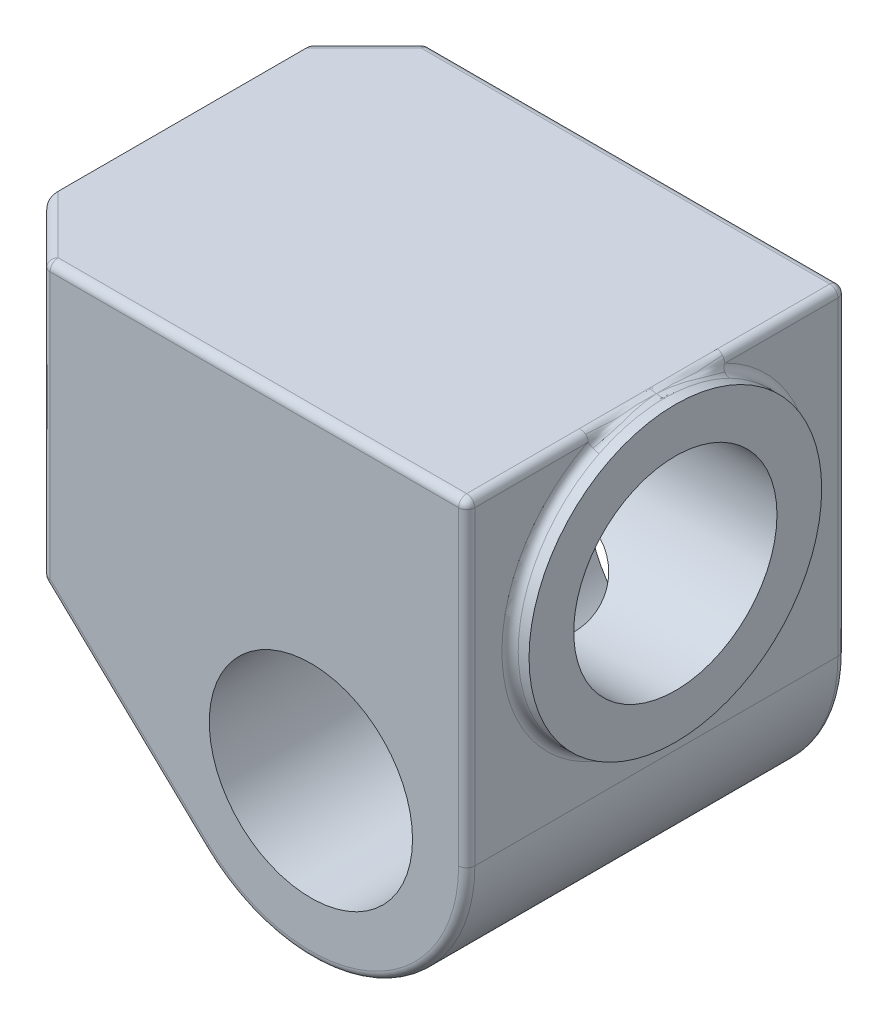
SolidWorks part; units mm, degrees
ref_plane "Front Plane" through (0, 0, 0) normal (0, 0, 1) x (1, 0, 0)
ref_plane "Top Plane" through (0, 0, 0) normal (0, 1, 0) x (1, 0, 0)
ref_plane "Right Plane" through (0, 0, 0) normal (1, 0, 0) x (0, 0, -1)
sketch "Sketch1" plane through (0, 0, 0) normal (0, 0, 1) x (1, 0, 0)
  line L0 (57.5, 0) -> (57.5, 117.5)
  line L1 (-117.5, 117.5) -> (-117.5, 32.5)
  line L2 (-117.5, 117.5) -> (57.5, 117.5)
  line L8 (-39.6552, -41.6379) -> (-117.5, 32.5)
  arc A0 (-39.6552, -41.6379) -> (57.5, 0) centre (0, 0) ccw
  dimension "D1" = 115
  dimension "D2" = 175
  dimension "D4" = 175
  dimension "D5" = 85
extrude "Base" add sketch "Sketch1" along normal mid plane 140
sketch "Sketch2" plane through (57.5, 0, 0) normal (1, 0, 0) x (0, 0, -1)
  line L1 (-70, 117.5) -> (70, 117.5) construction
  circle A0 centre (0, 63.5) radius 54
  dimension "D1" = 108
extrude "Boss-Extrude1" add sketch "Sketch2" along normal blind 7
sketch "Sketch4" plane through (0, 0, 70) normal (0, 0, 1) x (1, 0, 0)
  circle A0 centre (0, 0) radius 37.5
  dimension "D1" = 75
extrude "Cut-Extrude1" cut sketch "Sketch4" against normal through all
chamfer "Chamfer1" distance 20 angle 45 2 edges at (-117.5, 75, 70) (-117.5, 75, -70)
fillet "Fillet1" radius 3 11 edges at (57.5, 58.75, 70) (57.5, 58.75, -70) (22.6504, -52.8508, 70) (22.6504, -52.8508, -70) (-68.5776, -14.0928, 70) (-68.5776, -14.0928, -70) (57.5, 63.5, -54) (-20, 117.5, 70) (57.5, 117.5, 35) (-20, 117.5, -70) (57.5, 117.5, -35)
fillet "Fillet2" radius 3 13 edges at (-97.5, 66.0476, 70) (-117.5, 75, 50) (-117.5, 75, -50) (-97.5, 66.0476, -70) (-109, 24.4048, -58.5) (-117.5, 32.5, 0) (-109, 24.4048, 58.5) (-109, 117.5, 58.5) (-109, 117.5, -58.5) (-98.3787, 116.6213, 69.1213) (-98.3787, 15.5026, 69.1213) (-98.3787, 116.6213, -69.1213) (-98.3787, 15.5026, -69.1213)
sketch "Sketch5" plane through (64.5, 61.8075, -14.7193) normal (1, 0, 0) x (0, 0, -1)
  circle A0 centre (-14.7193, 1.6925) radius 37.5
  circle A1 centre (-14.7193, 1.6925) radius 54 construction
  dimension "D1" = 75
extrude "Cut-Extrude2" cut sketch "Sketch5" against normal through all
